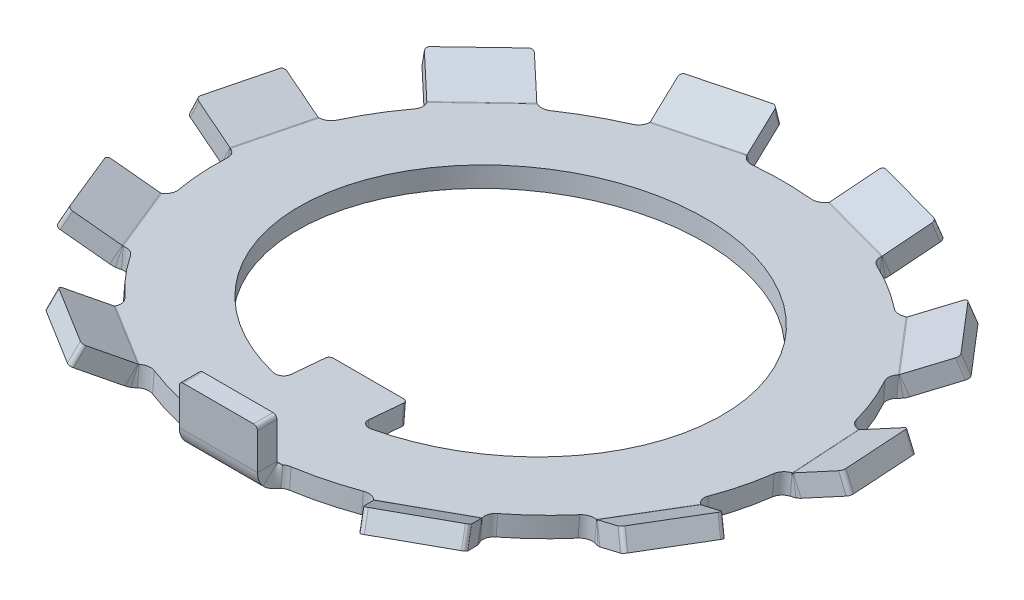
SolidWorks part; units mm, degrees
ref_plane "Plan1" through (0, 0, 0) normal (0, 0, 1) x (1, 0, 0)
ref_plane "Plan2" through (0, 0, 0) normal (0, 1, 0) x (1, 0, 0)
ref_plane "Plan3" through (0, 0, 0) normal (1, 0, 0) x (0, 0, -1)
sketch "Esquisse2" plane through (0, 0, 0) normal (1, 0, 0) x (0, 0, -1)
  line L0 (0, 10) -> (0, 14)
  line L1 (0, 14) -> (0, -14) construction
  line L2 (5.5, 9.5) -> (0.5, 9.5) construction
  line L3 (0, 0) -> (12.9901, 0) construction
  line L6 (0, 9.5) -> (6, 9.5) construction
  line L8 (6, 2) -> (6, 15.6729) construction
  dimension "D3" = 1
revolve "Base-Révol.-Mince" add sketch "Esquisse2" angle 360 about L3
sketch "Esquisse3" plane through (0, 0, 1) normal (0, 0, 1) x (1, 0, 0)
  line L0 (-2, 14.3666) -> (-2, 16.6745)
  line L1 (-1.8, 16.8745) -> (1.8, 16.8745)
  line L2 (2, 16.6745) -> (2, 14.3666)
  line L3 (-2, 13.8745) -> (-2, 15.8745) construction
  line L4 (2, 15.8745) -> (2, 13.8745) construction
  line L5 (0, 16.8745) -> (0, 10) construction
  line L6 (-2.4932, 13.7762) -> (2.4932, 13.7762)
  arc A0 (-1.8, 16.8745) -> (-2, 16.6745) centre (-1.8, 16.6745) ccw
  circle A1 centre (0, 0) radius 10 construction
  arc A2 (-2, 14.3666) -> (-2.4932, 13.7762) centre (-2.6, 14.3666) cw
  circle A3 centre (0, 0) radius 14 construction
  arc A4 (2, 14.3666) -> (2.4932, 13.7762) centre (2.6, 14.3666) ccw
  arc A5 (2, 16.6745) -> (1.8, 16.8745) centre (1.8, 16.6745) ccw
  dimension "D2" = 0.6
  dimension "D3" = 0.2
  dimension "D1" = 1
extrude "Boss.-Extru.1" add sketch "Esquisse3" along normal up to surface (1 mm away)
pattern_circular "Répétition circulaire1" count 11 over 360 about axis through (0, 0, 0) along (0, 0, -1)
sketch "Esquisse4" plane through (0, 0, 0) normal (0, 0, -1) x (-1, 0, 0)
  line L0 (-2, 9.2952) -> (-2, 7.4952)
  line L1 (-1.8, 7.2952) -> (1.8, 7.2952)
  line L2 (2, 7.4952) -> (2, 9.2952)
  line L3 (2, 14.3666) -> (2, 16.6745) construction
  line L4 (-2, 16.6745) -> (-2, 14.3666) construction
  line L5 (0, 7.2952) -> (0, 10) construction
  circle A0 centre (0, 0) radius 10 construction
  arc A1 (-2, 9.2952) -> (-2.5, 9.6825) centre (-2.4, 9.2952) ccw
  arc A2 (2, 9.2952) -> (2.5, 9.6825) centre (2.4, 9.2952) cw
  arc A3 (2.5, 9.6825) -> (-2.5, 9.6825) centre (0, 0) ccw
  arc A4 (1.8, 7.2952) -> (2, 7.4952) centre (1.8, 7.4952) ccw
  arc A5 (-2, 7.4952) -> (-1.8, 7.2952) centre (-1.8, 7.4952) ccw
  point P20 (-2, 7.2952)
  dimension "D1" = 0.4
  dimension "D3" = 0.2
  dimension "D2" = 2
extrude "Boss.-Extru.2" add sketch "Esquisse4" along normal up to surface (1 mm away)
sheet metal parameters "Tôlerie 1" parameters "D1"=0.1, "Epaisseur"=1
flatten bends "Dépliage 1" parameters "D1"=0
sketch "Esquisse-Angle1" plane through (0, 0, 0) normal (0, 0, -1) x (-1, 0, 0)
process bends "Pliage 1" parameters "D1"=0
sketch "Esquisse-Plate1" plane through (0, 0, 0) normal (0, 0, -1) x (-1, 0, 0)
  line L0 (2, 14.3666) -> (-2, 14.3666)
  line L1 (-6.0847, 13.1673) -> (-9.4497, 11.0047)
  line L2 (-12.2375, 7.7874) -> (-13.8992, 4.1488)
  line L3 (-14.505, -0.0649) -> (-13.9358, -4.0242)
  line L4 (-12.1673, -7.8966) -> (-9.5479, -10.9196)
  line L5 (-5.9665, -13.2212) -> (-2.1286, -14.3481)
  line L6 (2.1286, -14.3481) -> (5.9665, -13.2212)
  line L7 (9.5479, -10.9196) -> (12.1673, -7.8966)
  line L8 (14.505, -0.0649) -> (13.9358, -4.0242)
  line L9 (13.8992, 4.1488) -> (12.2375, 7.7874)
  line L10 (6.0847, 13.1673) -> (9.4497, 11.0047)
  point P2 (0, 15.1666)
bend "Pli défini à plat1" bend angle 85 parameters "D1"=0, "D5"=1
bend "Pli défini à plat2" bend angle 25 parameters "D1"=0, "D5"=2
bend "Pli défini à plat3" bend angle 25 parameters "D1"=0, "D5"=3
bend "Pli défini à plat4" bend angle 25 parameters "D1"=0, "D5"=4
bend "Pli défini à plat5" bend angle 25 parameters "D1"=0, "D5"=5
bend "Pli défini à plat6" bend angle 25 parameters "D1"=0, "D5"=6
bend "Pli défini à plat7" bend angle 25 parameters "D1"=0, "D5"=7
bend "Pli défini à plat8" bend angle 25 parameters "D1"=0, "D5"=8
bend "Pli défini à plat9" bend angle 25 parameters "D1"=0, "D5"=9
bend "Pli défini à plat10" bend angle 25 parameters "D1"=0, "D5"=10
bend "Pli défini à plat11" bend angle 25 parameters "D1"=0, "D5"=11
